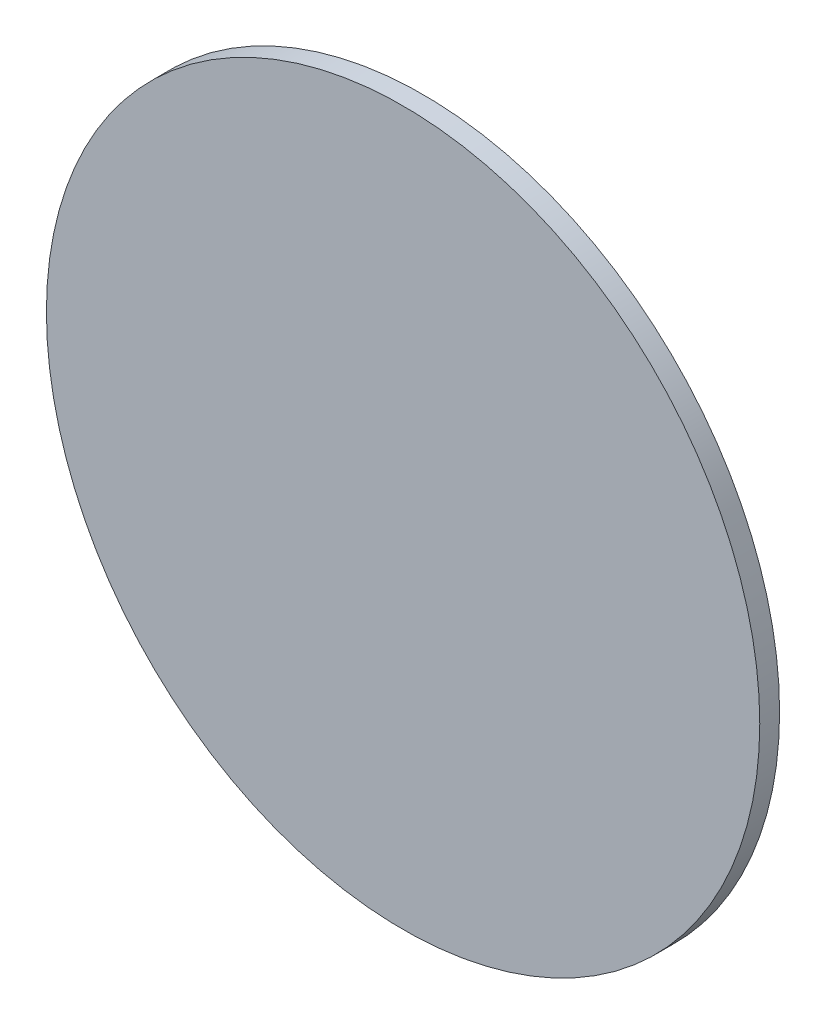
SolidWorks part; units mm, degrees
ref_plane "Plan XY" through (0, 0, 0) normal (0, 0, 1) x (1, 0, 0)
ref_plane "Plan XZ" through (0, 0, 0) normal (0, 1, 0) x (1, 0, 0)
ref_plane "Plan YZ" through (0, 0, 0) normal (1, 0, 0) x (0, 0, -1)
sketch "Esquisse1" plane through (0, 0, 0) normal (0, 0, 1) x (1, 0, 0)
  circle A0 centre (0, 0) radius 27
  dimension "D1" = 54
extrude "Boss.-Extru.1" add sketch "Esquisse1" along normal blind 1.5
